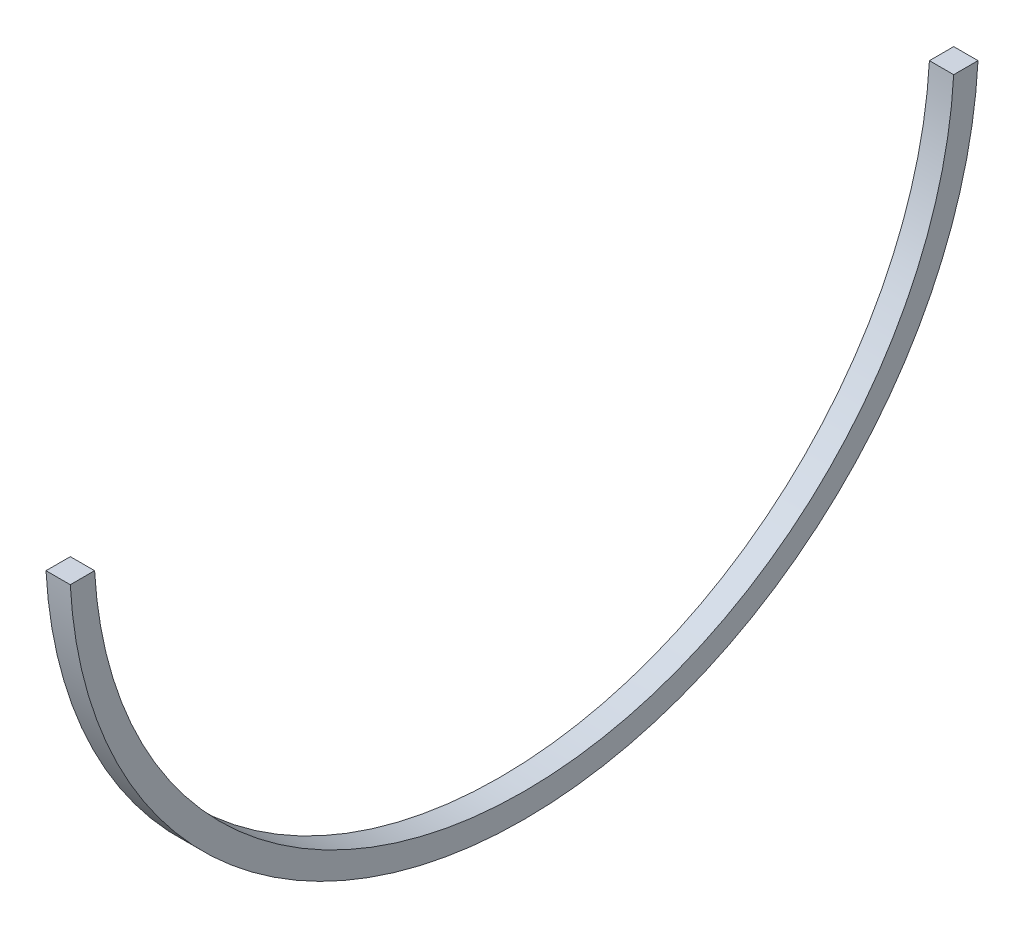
SolidWorks part; units mm, degrees
ref_plane "Plan de face" through (0, 0, 0) normal (0, 0, 1) x (1, 0, 0)
ref_plane "Plan de dessus" through (0, 0, 0) normal (0, 1, 0) x (1, 0, 0)
ref_plane "Plan de droite" through (0, 0, 0) normal (1, 0, 0) x (0, 0, -1)
sketch "Esquisse1" plane through (828, 0, 0) normal (1, 0, 0) x (0, 0, -1)
  line L0 (-85, -5) -> (-93, -5) construction
  line L1 (93, -5) -> (85, -5) construction
  line L2 (-88.4588, -5) -> (-93.4664, -5)
  line L3 (93.4664, -5) -> (88.4588, -5)
  arc A0 (-93.4664, -5) -> (93.4664, -5) centre (0, 0) ccw
  arc A1 (-88.4588, -5) -> (88.4588, -5) centre (0, 0) ccw
  arc A3 (-88.4735, -4.7329) -> (88.4735, -4.7329) centre (0, 0) ccw construction
  dimension "D1" = 187.2
  dimension "D2" = 5
extrude "Boss.-Extru.1" add sketch "Esquisse1" along normal blind 5
